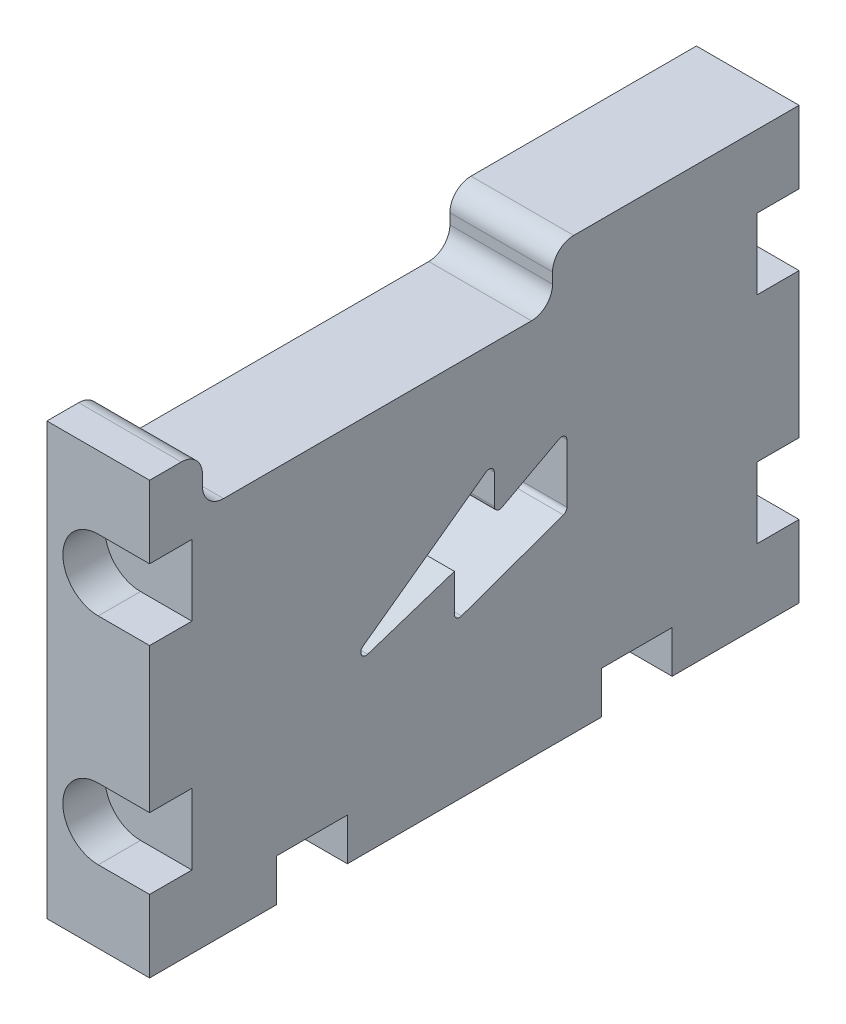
SolidWorks part; units mm, degrees
ref_plane "Front Plane" through (0, 0, 0) normal (0, 0, 1) x (1, 0, 0)
ref_plane "Top Plane" through (0, 0, 0) normal (0, 1, 0) x (1, 0, 0)
ref_plane "Right Plane" through (0, 0, 0) normal (1, 0, 0) x (0, 0, -1)
sketch "Sketch1" plane through (0, 0, 0) normal (0, 0, 1) x (1, 0, 0)
  line L6 (-810.8141, 612.9135) -> (-817.6657, 612.9135)
  line L7 (-810.8141, 612.9135) -> (-779.225, 612.9135)
  line L8 (-493.7649, 564.4955) -> (-493.7649, 1167.7963)
  line L9 (-493.7649, 1167.7963) -> (-817.6657, 1167.7963)
  line L10 (-817.6657, 1167.7963) -> (-817.6657, 564.4955)
  line L11 (-817.6657, 564.4955) -> (-493.7649, 564.4955)
  line L12 (-779.225, 612.9135) -> (-779.225, 571.3471)
  line L13 (-779.225, 571.3471) -> (-779.225, 564.4955)
  circle A2 centre (-798.6157, 583.5455) radius 2.667
extrude "Boss-Extrude1" add sketch "Sketch1" along normal blind 6.35 contours L13 L12 L7 L6 L10 L11 A2
sketch "Sketch2" plane through (0, 0, 6.35) normal (0, 0, 1) x (1, 0, 0)
  line L0 (-779.225, 564.4955) -> (-779.225, 555.0975)
  line L1 (-817.6657, 612.9135) -> (-827.0637, 612.9135)
  line L3 (-827.0637, 612.9135) -> (-779.225, 612.9135)
  line L4 (-779.225, 564.4955) -> (-779.225, 612.9135)
  line L5 (-779.225, 612.9135) -> (-817.6657, 612.9135)
  line L6 (-817.6657, 612.9135) -> (-817.6657, 564.4955)
  line L7 (-817.6657, 564.4955) -> (-779.225, 564.4955)
  line L8 (-779.225, 564.4955) -> (-779.225, 612.9135)
  line L9 (-779.225, 612.9135) -> (-817.6657, 612.9135)
  line L10 (-817.6657, 612.9135) -> (-817.6657, 564.4955)
  line L11 (-817.6657, 564.4955) -> (-779.225, 564.4955)
  line L12 (-827.0637, 612.9135) -> (-827.0637, 555.0975)
  line L13 (-827.0637, 555.0975) -> (-779.225, 555.0975)
  line L14 (-779.225, 612.9135) -> (-779.225, 555.0975)
  dimension "D2" = 9.398
  dimension "D1" = 0
extrude "Boss-Extrude2" add sketch "Sketch2" against normal up to vertex (996.0964 mm away) contours L12 L13 L0 L1 M15 M14
sketch "Sketch6" plane through (0, 0, 0) normal (0, 0, -1) x (-1, 0, 0)
  line L4 (779.225, 612.9135) -> (779.225, 555.0975)
  line L5 (779.225, 555.0975) -> (827.0637, 555.0975)
  line L6 (827.0637, 555.0975) -> (827.0637, 612.9135)
  line L7 (827.0637, 612.9135) -> (779.225, 612.9135)
  line L8 (779.225, 612.9135) -> (779.225, 555.0975)
  line L9 (779.225, 555.0975) -> (827.0637, 555.0975)
  line L10 (827.0637, 555.0975) -> (827.0637, 612.9135)
  line L11 (827.0637, 612.9135) -> (779.225, 612.9135)
  line L12 (804.9657, 562.1587) -> (817.4117, 562.1587)
  line L14 (819.1897, 562.1587) -> (820.0025, 562.1587)
  line L15 (820.0025, 562.1587) -> (820.0025, 612.9135)
  line L20 (817.4117, 562.1587) -> (819.1897, 562.1587)
  line L21 (804.9657, 562.1587) -> (779.225, 562.1587)
  dimension "D1" = 0
extrude "Boss-Extrude4" add sketch "Sketch6" along normal up to surface (78.0796 mm away) contours L12 L21 L8 L15 L14 L20 M11 M12 M13
sketch "Sketch7" plane through (0, 0, -78.0796) normal (0, 0, -1) x (-1, 0, 0)
  line L6 (805.2197, 576.9415) -> (805.2197, 612.9135)
  line L7 (779.225, 576.9415) -> (804.6609, 576.9415)
  line L8 (820.0025, 612.9135) -> (827.0637, 612.9135)
  line L9 (827.0637, 612.9135) -> (827.0637, 555.0975)
  line L10 (827.0637, 555.0975) -> (779.225, 555.0975)
  line L11 (779.225, 555.0975) -> (779.225, 562.1587)
  line L12 (779.225, 562.1587) -> (779.225, 576.9415)
  line L13 (820.0025, 612.9135) -> (805.2197, 612.9135)
  line L14 (804.6609, 576.9415) -> (805.2197, 576.9415)
  circle A2 centre (791.9609, 571.3471) radius 2.3812
  circle A3 centre (810.8141, 600.2587) radius 2.3812
sketch "Sketch8" plane through (0, 0, -78.0796) normal (0, 0, -1) x (-1, 0, 0)
  line L9 (805.2197, 612.9135) -> (805.2197, 576.9415)
  line L10 (820.0025, 612.9135) -> (805.2197, 612.9135)
  line L11 (827.0637, 612.9135) -> (820.0025, 612.9135)
  line L12 (827.0637, 555.0975) -> (827.0637, 612.9135)
  line L13 (779.225, 555.0975) -> (827.0637, 555.0975)
  line L14 (779.225, 562.1587) -> (779.225, 555.0975)
  line L15 (779.225, 576.9415) -> (779.225, 562.1587)
  line L16 (804.6609, 576.9415) -> (779.225, 576.9415)
  line L17 (805.2197, 576.9415) -> (804.6609, 576.9415)
  line L18 (805.2197, 612.9135) -> (805.2197, 576.9415)
  line L19 (820.0025, 612.9135) -> (805.2197, 612.9135)
  line L20 (827.0637, 612.9135) -> (820.0025, 612.9135)
  line L21 (827.0637, 555.0975) -> (827.0637, 612.9135)
  line L22 (779.225, 555.0975) -> (827.0637, 555.0975)
  line L23 (779.225, 562.1587) -> (779.225, 555.0975)
  line L24 (779.225, 576.9415) -> (779.225, 562.1587)
  line L25 (804.6609, 576.9415) -> (779.225, 576.9415)
  line L26 (805.2197, 576.9415) -> (804.6609, 576.9415)
  circle A1 centre (810.8141, 600.2587) radius 2.3813
  circle A2 centre (810.8141, 600.2587) radius 2.3812
  circle A3 centre (791.9609, 571.3471) radius 2.3813
  circle A4 centre (791.9609, 571.3471) radius 2.3812
  dimension "D1" = 0
  dimension "D2" = 0
  dimension "D3" = 0
extrude "Boss-Extrude6" add sketch "Sketch8" along normal blind 2.54
other "Cavity1"
other "5 SIDED ENCLOSURE 3 INCH.stp<1>@Assem11"
sketch "Sketch9" plane through (0, 612.9135, 0) normal (0, 1, 0) x (1, 0, 0)
  line L0 (-820.7645, 76.454) -> (-820.8153, 73.0504)
  line L1 (-820.8153, 3.1496) -> (-820.8153, 0)
  line L2 (-820.8153, 0) -> (-820.0025, 0)
  line L3 (-820.0025, 76.454) -> (-820.0025, 78.0796)
  line L4 (-820.0025, 78.0796) -> (-820.0025, 0)
  line L5 (-820.8153, 0) -> (-821.0693, 0)
  line L6 (-821.0693, 0) -> (-821.0693, 78.0796)
  line L7 (-821.0693, 78.0796) -> (-820.7645, 78.0796)
  line L12 (-820.7645, 76.454) -> (-820.7645, 78.0796)
  line L13 (-820.7645, 78.0796) -> (-805.2197, 78.0796)
  line L14 (-805.2197, 78.0796) -> (-805.2197, 80.6196)
  line L15 (-805.2197, 80.6196) -> (-827.0637, 80.6196)
  line L16 (-827.0637, 80.6196) -> (-827.0637, -6.35)
  line L17 (-827.0637, -6.35) -> (-779.225, -6.35)
  line L18 (-779.225, -6.35) -> (-779.225, 0)
  line L19 (-779.225, 0) -> (-820.0025, 0)
  line L20 (-820.0025, 0) -> (-820.0025, 1.0379)
  line L21 (-820.8153, 3.1496) -> (-820.8153, 73.0504)
  line L22 (-820.0025, 75.1621) -> (-820.0025, 76.454)
  line L23 (-820.0025, 76.454) -> (-820.7645, 76.454)
  line L24 (-820.7645, 76.454) -> (-820.7645, 78.0796)
  line L25 (-820.7645, 78.0796) -> (-805.2197, 78.0796)
  line L26 (-805.2197, 78.0796) -> (-805.2197, 80.6196)
  line L27 (-805.2197, 80.6196) -> (-827.0637, 80.6196)
  line L28 (-827.0637, 80.6196) -> (-827.0637, -6.35)
  line L29 (-827.0637, -6.35) -> (-779.225, -6.35)
  line L30 (-779.225, -6.35) -> (-779.225, 0)
  line L31 (-779.225, 0) -> (-820.0025, 0)
  line L32 (-820.0025, 0) -> (-820.0025, 1.0379)
  line L33 (-820.8153, 3.1496) -> (-820.8153, 73.0504)
  line L34 (-820.0025, 75.1621) -> (-820.0025, 76.454)
  line L35 (-820.0025, 76.454) -> (-820.7645, 76.454)
  arc A2 (-820.8153, 3.1496) -> (-820.0025, 1.0379) centre (-817.6657, 3.1496) ccw
  arc A3 (-820.0025, 75.1621) -> (-820.8153, 73.0504) centre (-817.6657, 73.0504) ccw
  arc A4 (-820.8153, 3.1496) -> (-820.0025, 1.0379) centre (-817.6657, 3.1496) ccw
  arc A5 (-820.0025, 75.1621) -> (-820.8153, 73.0504) centre (-817.6657, 73.0504) ccw
  dimension "D2" = 0.254
  dimension "D1" = 0
extrude "Cut-Extrude3" cut sketch "Sketch9" against normal up to surface (50.7548 mm away) contours L0 M28 M26 M27 | L7 L6 L5 L1 L0 M25 M26 M15 | L1 L2 M23 M24
sketch "Sketch10" plane through (-779.225, 0, 0) normal (1, 0, 0) x (0, 0, -1)
  line L0 (78.0796, 561.3459) -> (78.0796, 561.0919)
  line L1 (78.0796, 561.0919) -> (0, 561.0919)
  line L2 (0, 561.0919) -> (0, 562.1587)
  line L4 (24.4475, 562.1587) -> (24.4475, 561.3459) construction
  line L5 (24.4475, 562.1587) -> (24.4475, 561.3459)
  line L6 (0, 562.4127) -> (0, 562.1587)
  line L7 (0, 562.4127) -> (78.0796, 562.4127)
  line L8 (76.1963, 562.4127) -> (76.1963, 562.1587)
  line L9 (78.0796, 562.4127) -> (76.1963, 562.4127)
  line L10 (78.0796, 562.4127) -> (78.0796, 565.7277)
  line L11 (78.0796, 565.7277) -> (76.1963, 565.7277)
  line L12 (78.0796, 576.9415) -> (78.0796, 561.3459)
  line L13 (78.0796, 561.3459) -> (76.454, 561.3459)
  line L14 (76.454, 561.3459) -> (76.454, 562.1587)
  line L15 (76.454, 562.1587) -> (75.1621, 562.1587)
  line L16 (73.0504, 561.3459) -> (3.1496, 561.3459)
  line L17 (1.0379, 562.1587) -> (0, 562.1587)
  line L18 (0, 562.1587) -> (0, 612.9135)
  line L19 (0, 612.9135) -> (-6.35, 612.9135)
  line L20 (-6.35, 612.9135) -> (-6.35, 555.0975)
  line L21 (-6.35, 555.0975) -> (80.6196, 555.0975)
  line L22 (80.6196, 555.0975) -> (80.6196, 576.9415)
  line L23 (80.6196, 576.9415) -> (78.0796, 576.9415)
  line L24 (78.0796, 576.9415) -> (78.0796, 561.3459)
  line L25 (78.0796, 561.3459) -> (76.454, 561.3459)
  line L26 (76.454, 561.3459) -> (76.454, 562.1587)
  line L27 (76.454, 562.1587) -> (75.1621, 562.1587)
  line L28 (73.0504, 561.3459) -> (3.1496, 561.3459)
  line L29 (1.0379, 562.1587) -> (0, 562.1587)
  line L30 (0, 562.1587) -> (0, 612.9135)
  line L31 (0, 612.9135) -> (-6.35, 612.9135)
  line L32 (-6.35, 612.9135) -> (-6.35, 555.0975)
  line L33 (-6.35, 555.0975) -> (80.6196, 555.0975)
  line L34 (80.6196, 555.0975) -> (80.6196, 576.9415)
  line L35 (80.6196, 576.9415) -> (78.0796, 576.9415)
  line L36 (76.1963, 562.4127) -> (76.1963, 565.7277)
  line L37 (0, 561.0919) -> (3.4229, 561.0919)
  line L38 (0, 561.0919) -> (0, 564.0863)
  line L39 (0, 564.0863) -> (3.4229, 564.0863)
  line L40 (3.4229, 561.0919) -> (3.4229, 564.0863)
  arc A2 (73.0504, 561.3459) -> (75.1621, 562.1587) centre (73.0504, 564.4955) ccw
  arc A3 (1.0379, 562.1587) -> (3.1496, 561.3459) centre (3.1496, 564.4955) ccw
  arc A4 (73.0504, 561.3459) -> (75.1621, 562.1587) centre (73.0504, 564.4955) ccw
  arc A5 (1.0379, 562.1587) -> (3.1496, 561.3459) centre (3.1496, 564.4955) ccw
  dimension "D2" = 0.254
  dimension "D3" = 0.254
  dimension "D1" = 0
extrude "Cut-Extrude5" cut sketch "Sketch10" against normal up to surface (41.8444 mm away)
sketch "Sketch12" plane through (0, 0, -80.6196) normal (0, 0, -1) x (-1, 0, 0)
  line L6 (827.0637, 612.9135) -> (805.2197, 612.9135)
  line L7 (805.2197, 612.9135) -> (805.2197, 576.9415)
  line L8 (805.2197, 576.9415) -> (779.225, 576.9415)
  line L9 (779.225, 576.9415) -> (779.225, 555.0975)
  line L10 (779.225, 555.0975) -> (827.0637, 555.0975)
  line L11 (827.0637, 555.0975) -> (827.0637, 612.9135)
  line L12 (827.0637, 612.9135) -> (805.2197, 612.9135)
  line L13 (805.2197, 612.9135) -> (805.2197, 576.9415)
  line L14 (805.2197, 576.9415) -> (779.225, 576.9415)
  line L15 (779.225, 576.9415) -> (779.225, 555.0975)
  line L16 (779.225, 555.0975) -> (827.0637, 555.0975)
  line L17 (827.0637, 555.0975) -> (827.0637, 612.9135)
  circle A1 centre (791.9609, 571.3471) radius 2.3813
  circle A2 centre (791.9609, 571.3471) radius 2.3812
  circle A3 centre (810.8141, 600.2587) radius 2.3813
  circle A4 centre (810.8141, 600.2587) radius 2.3812
  dimension "D1" = 0
  dimension "D2" = 0
  dimension "D3" = 0
extrude "Boss-Extrude7" add sketch "Sketch12" along normal blind 3.81
sketch "Sketch13" plane through (0, 0, -84.4296) normal (0, 0, -1) x (-1, 0, 0)
  line L0 (797.5235, 571.3471) -> (797.5235, 576.9415)
  line L1 (805.2197, 576.9415) -> (779.225, 576.9415) construction
  line L2 (786.3983, 571.3471) -> (786.3983, 576.9415)
  line L3 (810.8141, 594.6961) -> (805.2197, 594.6961)
  line L4 (805.2197, 612.9135) -> (805.2197, 576.9415) construction
  line L5 (810.8141, 605.8213) -> (805.2197, 605.8213)
  line L12 (827.0637, 612.9135) -> (805.2197, 612.9135)
  line L13 (805.2197, 612.9135) -> (805.2197, 576.9415)
  line L14 (805.2197, 576.9415) -> (779.225, 576.9415)
  line L15 (779.225, 576.9415) -> (779.225, 555.0975)
  line L16 (779.225, 555.0975) -> (827.0637, 555.0975)
  line L17 (827.0637, 555.0975) -> (827.0637, 612.9135)
  line L18 (827.0637, 612.9135) -> (805.2197, 612.9135)
  line L19 (805.2197, 612.9135) -> (805.2197, 576.9415)
  line L20 (805.2197, 576.9415) -> (779.225, 576.9415)
  line L21 (779.225, 576.9415) -> (779.225, 555.0975)
  line L22 (779.225, 555.0975) -> (827.0637, 555.0975)
  line L23 (827.0637, 555.0975) -> (827.0637, 612.9135)
  circle A2 centre (810.8141, 600.2587) radius 3.0226
  circle A3 centre (791.9609, 571.3471) radius 3.0226
  circle A4 centre (791.9609, 571.3471) radius 5.5626
  circle A5 centre (810.8141, 600.2587) radius 5.5626
  dimension "D1" = 2.54
  dimension "D2" = 0
extrude "Cut-Extrude7" cut sketch "Sketch13" against normal blind 5.715 contours M16 | A5 A2 | A5 L5 L3 M7 | M3 | A3 M3 | A4 A3 | A4 L0 L2 M9
fillet "Fillet3" radius 1.27 4 edges at (-805.2197, 605.8213, -81.5721) (-805.2197, 594.6961, -81.5721) (-797.5235, 576.9415, -81.5721) (-786.3983, 576.9415, -81.5721)
sketch "Sketch14" plane through (0, 0, 6.35) normal (0, 0, 1) x (1, 0, 0)
  line L4 (-779.225, 612.9135) -> (-827.0637, 612.9135)
  line L5 (-827.0637, 612.9135) -> (-827.0637, 555.0975)
  line L6 (-827.0637, 555.0975) -> (-779.225, 555.0975)
  line L7 (-779.225, 555.0975) -> (-779.225, 612.9135)
  line L8 (-779.225, 612.9135) -> (-827.0637, 612.9135)
  line L9 (-827.0637, 612.9135) -> (-827.0637, 555.0975)
  line L10 (-827.0637, 555.0975) -> (-779.225, 555.0975)
  line L11 (-779.225, 555.0975) -> (-779.225, 612.9135)
  circle A1 centre (-798.6157, 583.5455) radius 12.7
  circle A2 centre (-798.6157, 583.5455) radius 12.954
  dimension "D1" = 0
  dimension "D2" = 0.254
extrude "Cut-Extrude8" cut sketch "Sketch14" against normal blind 5.715 contours A2 A1 | A1 M9 | M9
fillet "Fillet4" radius 2.54 3 edges at (-779.225, 576.9415, -81.2546) (-805.2197, 612.9135, -81.2546) (-779.225, 612.9135, 3.175)
sketch "Sketch15" plane through (-779.225, 0, 0) normal (1, 0, 0) x (0, 0, -1)
  line L4 (-6.35, 612.9135) -> (-6.35, 555.0975)
  line L5 (84.4296, 612.9135) -> (-6.35, 612.9135)
  line L6 (84.4296, 555.0975) -> (84.4296, 612.9135)
  line L7 (-6.35, 555.0975) -> (84.4296, 555.0975)
  line L8 (-6.35, 612.9135) -> (-6.35, 555.0975)
  line L9 (84.4296, 612.9135) -> (-6.35, 612.9135)
  line L10 (84.4296, 555.0975) -> (84.4296, 612.9135)
  line L11 (-6.35, 555.0975) -> (84.4296, 555.0975)
  dimension "D1" = 0
extrude "Cut-Extrude9" cut sketch "Sketch15" against normal up to surface (41.8444 mm away)
sketch "Sketch16" plane through (-827.0637, 0, 0) normal (-1, 0, 0) x (0, 0, 1)
  line L4 (6.35, 555.0975) -> (6.35, 612.9135)
  line L5 (6.35, 612.9135) -> (-84.4296, 612.9135)
  line L6 (-84.4296, 612.9135) -> (-84.4296, 555.0975)
  line L7 (-84.4296, 555.0975) -> (6.35, 555.0975)
  line L8 (6.35, 555.0975) -> (6.35, 612.9135)
  line L9 (6.35, 612.9135) -> (-84.4296, 612.9135)
  line L10 (-84.4296, 612.9135) -> (-84.4296, 555.0975)
  line L11 (-84.4296, 555.0975) -> (6.35, 555.0975)
  dimension "D1" = 0
extrude "Boss-Extrude8" add sketch "Sketch16" along normal blind 6.35
sketch "Sketch17" plane through (0, 555.0975, 0) normal (0, -1, 0) x (1, 0, 0)
  line L4 (-833.4137, -84.4296) -> (-821.0693, -84.4296)
  line L5 (-821.0693, -84.4296) -> (-821.0693, 6.35)
  line L6 (-821.0693, 6.35) -> (-833.4137, 6.35)
  line L7 (-833.4137, 6.35) -> (-833.4137, -84.4296)
  line L8 (-833.4137, -84.4296) -> (-821.0693, -84.4296)
  line L9 (-821.0693, -84.4296) -> (-821.0693, 6.35)
  line L10 (-821.0693, 6.35) -> (-833.4137, 6.35)
  line L11 (-833.4137, 6.35) -> (-833.4137, -84.4296)
  dimension "D1" = 0
extrude "Boss-Extrude9" add sketch "Sketch17" along normal up to surface (6.35 mm away)
other "Cavity2"
other "Bottom<1>@Bumper Assembly1"
other "Top<1>@Bumper Assembly1"
other "Cavity3"
other "Short Side<1>@Bumper Assembly1"
sketch "Sketch18" plane through (0, 561.0919, 0) normal (0, -1, 0) x (1, 0, 0)
  line L0 (-827.0637, 0) -> (-827.0637, -78.0796)
  line L8 (-821.0693, -78.0796) -> (-821.0693, 0)
  line L9 (-821.0693, 0) -> (-827.0637, 0)
  line L10 (-827.0637, 0) -> (-827.0637, 6.35)
  line L11 (-827.0637, 6.35) -> (-833.4137, 6.35)
  line L12 (-833.4137, 6.35) -> (-833.4137, -84.4296)
  line L13 (-833.4137, -84.4296) -> (-827.0637, -84.4296)
  line L14 (-827.0637, -84.4296) -> (-827.0637, -78.0796)
  line L15 (-827.0637, -78.0796) -> (-821.0693, -78.0796)
  line L16 (-821.0693, -78.0796) -> (-821.0693, 0)
  line L17 (-821.0693, 0) -> (-827.0637, 0)
  line L18 (-827.0637, 0) -> (-827.0637, 6.35)
  line L19 (-827.0637, 6.35) -> (-833.4137, 6.35)
  line L20 (-833.4137, 6.35) -> (-833.4137, -84.4296)
  line L21 (-833.4137, -84.4296) -> (-827.0637, -84.4296)
  line L22 (-827.0637, -84.4296) -> (-827.0637, -78.0796)
  line L23 (-827.0637, -78.0796) -> (-821.0693, -78.0796)
  dimension "D1" = 0
extrude "Boss-Extrude10" add sketch "Sketch18" along normal blind 6.223 contours L0 M12 M13 M14 M15 M16
sketch "Sketch19" plane through (-833.4137, 0, 0) normal (-1, 0, 0) x (0, 0, 1)
  line L0 (-52.9158, 586.6596) -> (-52.9158, 578.1369)
  line L1 (-52.9158, 578.1369) -> (-39.386, 573.2896)
  line L2 (-39.386, 573.2896) -> (-39.386, 578.6696)
  line L3 (-39.386, 578.6696) -> (-25.1105, 573.9821)
  line L4 (-25.1105, 573.9821) -> (-44.1801, 587.8315)
  line L5 (-44.1801, 587.8315) -> (-44.1801, 581.9721)
  line L6 (-44.1801, 581.9721) -> (-52.9158, 586.6596)
extrude "Cut-Extrude10" [suppressed] cut sketch "Sketch19" against normal through all
other "Cavity4"
other "Bumper Assembly<1>@Assem1/Short Side<1>@Bumper Assembly1"
sketch "Sketch20" plane through (-833.4137, 0, 0) normal (-1, 0, 0) x (0, 0, 1)
  line L0 (6.35, 606.5635) -> (-84.4296, 606.5635)
  line L1 (-6.35, 555.0975) -> (-6.35, 612.9135)
  line L2 (-71.7296, 612.9135) -> (-71.7296, 555.0975)
  line L4 (-84.4296, 555.0975) -> (6.35, 555.0975)
  line L5 (6.35, 555.0975) -> (6.35, 612.9135)
  line L6 (6.35, 612.9135) -> (-84.4296, 612.9135)
  line L7 (-84.4296, 612.9135) -> (-84.4296, 555.0975)
  line L9 (6.35, 555.0975) -> (6.35, 612.9135)
  line L10 (6.35, 612.9135) -> (-84.4296, 612.9135)
  line L11 (-84.4296, 612.9135) -> (-84.4296, 555.0975)
  line L15 (-84.4296, 555.0975) -> (6.35, 555.0975)
  dimension "D1" = 0
  dimension "D2" = 6.35
  dimension "D3" = 12.7
extrude "Cut-Extrude11" cut sketch "Sketch20" against normal up to surface (12.5984 mm away) contours L2 L0 L1 M8
fillet "Fillet5" radius 2.54 1 edges at (-827.2415, 606.5635, -6.35)
fillet "Fillet6" radius 2.54 1 edges at (-827.2415, 612.9135, -6.35)
sketch "Sketch21" plane through (-833.4137, 0, 0) normal (-1, 0, 0) x (0, 0, 1)
  line L0 (-27.3967, 618.0752) -> (-27.3967, 623.9576)
  line L1 (-48.4434, 610.3735) -> (-48.4434, 609.1035)
  line L2 (-14.1267, 613.4714) -> (-14.1267, 628.0114)
  line L3 (-40.6667, 616.4063) -> (-40.6667, 618.0752)
  line L4 (-40.6667, 618.0752) -> (-14.1267, 618.0752)
  line L5 (-61.1434, 612.9135) -> (-50.9834, 612.9135)
  line L6 (-61.1434, 612.9135) -> (-71.7296, 612.9135)
  line L8 (6.35, 612.9135) -> (-3.81, 612.9135)
  line L9 (-6.35, 610.3735) -> (-6.35, 609.1035)
  line L10 (-8.89, 606.5635) -> (-71.7296, 606.5635)
  line L11 (-71.7296, 606.5635) -> (-71.7296, 612.9135)
  line L12 (-71.7296, 612.9135) -> (-84.4296, 612.9135)
  line L13 (-84.4296, 612.9135) -> (-84.4296, 555.0975)
  line L14 (-84.4296, 555.0975) -> (6.35, 555.0975)
  line L15 (6.35, 555.0975) -> (6.35, 612.9135)
  line L16 (6.35, 612.9135) -> (-3.81, 612.9135)
  line L17 (-6.35, 610.3735) -> (-6.35, 609.1035)
  line L18 (-8.89, 606.5635) -> (-71.7296, 606.5635)
  line L19 (-71.7296, 606.5635) -> (-71.7296, 612.9135)
  line L20 (-71.7296, 612.9135) -> (-84.4296, 612.9135)
  line L21 (-84.4296, 612.9135) -> (-84.4296, 555.0975)
  line L22 (-84.4296, 555.0975) -> (6.35, 555.0975)
  line L23 (6.35, 555.0975) -> (6.35, 612.9135)
  arc A0 (-45.9034, 606.5635) -> (-48.4434, 609.1035) centre (-45.9034, 609.1035) cw
  arc A1 (-50.9834, 612.9135) -> (-48.4434, 610.3735) centre (-50.9834, 610.3735) cw
  arc A2 (-3.81, 612.9135) -> (-6.35, 610.3735) centre (-3.81, 610.3735) ccw
  arc A3 (-8.89, 606.5635) -> (-6.35, 609.1035) centre (-8.89, 609.1035) ccw
  arc A4 (-3.81, 612.9135) -> (-6.35, 610.3735) centre (-3.81, 610.3735) ccw
  arc A5 (-8.89, 606.5635) -> (-6.35, 609.1035) centre (-8.89, 609.1035) ccw
  dimension "D1" = 0
extrude "Boss-Extrude11" add sketch "Sketch21" against normal up to surface (12.3444 mm away) contours A1 L5 L6 L18 A0 L1 M16
other "Cavity5"
other "Bumper Assembly<1>@CORNER MOUNT ASSEMBLY/Bottom<1>@Bumper Assembly1"
other "Bumper Assembly<1>@CORNER MOUNT ASSEMBLY/Top<1>@Bumper Assembly1"
other "Cavity6"
other "Bumper Assembly<1>@CORNER MOUNT ASSEMBLY/Short Side<1>@Bumper Assembly1"
sketch "Sketch22" plane through (0, 561.0919, 0) normal (0, -1, 0) x (1, 0, 0)
  line L6 (-827.2415, -54.3052) -> (-821.0693, -54.3052)
  line L7 (-821.0693, -54.3052) -> (-821.0693, -62.8142)
  line L8 (-821.0693, -62.8142) -> (-827.2415, -62.8142)
  line L9 (-827.2415, -15.2654) -> (-821.0693, -15.2654)
  line L10 (-821.0693, -15.2654) -> (-821.0693, -23.7744)
  line L11 (-821.0693, -23.7744) -> (-827.2415, -23.7744)
  arc A2 (-827.2415, -54.3052) -> (-827.2415, -62.8142) centre (-827.2415, -58.5597) ccw
  arc A3 (-827.2415, -15.2654) -> (-827.2415, -23.7744) centre (-827.2415, -19.5199) ccw
extrude "Cut-Extrude12" cut sketch "Sketch22" against normal blind 5.08
sketch "Sketch24" plane through (0, 0, 0) normal (0, 0, 1) x (1, 0, 0)
  line L1 (-493.7649, 564.4955) -> (-817.6657, 564.4955)
  line L8 (-484.1891, 604.2126) -> (-490.3613, 604.2126)
  line L9 (-490.3613, 604.2126) -> (-490.3613, 595.7036)
  line L10 (-490.3613, 595.7036) -> (-484.1891, 595.7036)
  line L11 (-484.1891, 578.3018) -> (-490.3613, 578.3018)
  line L12 (-490.3613, 578.3018) -> (-490.3613, 569.7928)
  line L13 (-490.3613, 569.7928) -> (-484.1891, 569.7928)
  line L14 (-655.7153, 564.4955) -> (-655.7153, 539.2154)
  line L15 (-821.0693, 569.7928) -> (-827.2415, 569.7928)
  line L16 (-821.0693, 578.3018) -> (-821.0693, 569.7928)
  line L17 (-827.2415, 578.3018) -> (-821.0693, 578.3018)
  line L18 (-821.0693, 595.7036) -> (-827.2415, 595.7036)
  line L19 (-821.0693, 604.2126) -> (-821.0693, 595.7036)
  line L20 (-827.2415, 604.2126) -> (-821.0693, 604.2126)
  arc A2 (-484.1891, 595.7036) -> (-484.1891, 604.2126) centre (-484.1891, 599.9581) ccw
  arc A3 (-484.1891, 569.7928) -> (-484.1891, 578.3018) centre (-484.1891, 574.0473) ccw
  arc A4 (-827.2415, 569.7928) -> (-827.2415, 578.3018) centre (-827.2415, 574.0473) cw
  arc A5 (-827.2415, 595.7036) -> (-827.2415, 604.2126) centre (-827.2415, 599.9581) cw
extrude "Cut-Extrude14" cut sketch "Sketch24" against normal blind 5.08 contours A4 L15 L17 M4 | A5 L18 L20 M4
sketch "Sketch25" plane through (0, 0, -78.0796) normal (0, 0, -1) x (-1, 0, 0)
  line L1 (818.2245, 561.3459) -> (493.1045, 561.3459)
  line L2 (655.6645, 561.3459) -> (655.6645, 523.78)
  line L9 (484.2907, 595.7036) -> (490.3613, 595.7036)
  line L10 (490.3613, 595.7036) -> (490.3613, 604.2126)
  line L11 (490.3613, 604.2126) -> (484.2907, 604.2126)
  line L12 (484.2907, 569.7928) -> (490.3613, 569.7928)
  line L13 (490.3613, 569.7928) -> (490.3613, 578.3018)
  line L14 (490.3613, 578.3018) -> (484.2907, 578.3018)
  line L15 (820.9677, 578.3018) -> (827.0383, 578.3018)
  line L16 (820.9677, 569.7928) -> (820.9677, 578.3018)
  line L17 (827.0383, 569.7928) -> (820.9677, 569.7928)
  line L18 (820.9677, 604.2126) -> (827.0383, 604.2126)
  line L19 (820.9677, 595.7036) -> (820.9677, 604.2126)
  line L20 (827.0383, 595.7036) -> (820.9677, 595.7036)
  arc A2 (484.2907, 604.2126) -> (484.2907, 595.7036) centre (484.2907, 599.9581) ccw
  arc A3 (484.2907, 578.3018) -> (484.2907, 569.7928) centre (484.2907, 574.0473) ccw
  arc A4 (827.0383, 578.3018) -> (827.0383, 569.7928) centre (827.0383, 574.0473) cw
  arc A5 (827.0383, 604.2126) -> (827.0383, 595.7036) centre (827.0383, 599.9581) cw
extrude "Cut-Extrude15" cut sketch "Sketch25" against normal blind 5.08 contours A4 L15 L17 M5 | A5 L18 L20 M5
sketch "Sketch26" plane through (-833.4137, 0, 0) normal (-1, 0, 0) x (0, 0, 1)
  line L14 (-42.372, 588.9161) -> (-49.2373, 592.5999)
  line L15 (-50.1726, 592.0403) -> (-50.1726, 585.026)
  line L16 (-49.7518, 584.4282) -> (-37.492, 580.036)
  line L17 (-36.6428, 580.6337) -> (-36.6428, 585.1117)
  line L18 (-36.6428, 585.1117) -> (-26.2174, 581.6884)
  line L19 (-25.6462, 582.8055) -> (-40.4287, 593.5414)
  line L20 (-41.4368, 593.0276) -> (-41.4368, 589.4756)
  arc A12 (-42.372, 588.9161) -> (-41.4368, 589.4756) centre (-42.0718, 589.4756) ccw
  arc A13 (-49.2373, 592.5999) -> (-50.1726, 592.0403) centre (-49.5376, 592.0403) ccw
  arc A14 (-50.1726, 585.026) -> (-49.7518, 584.4282) centre (-49.5376, 585.026) ccw
  arc A15 (-37.492, 580.036) -> (-36.6428, 580.6337) centre (-37.2778, 580.6337) ccw
  arc A16 (-26.2174, 581.6884) -> (-25.6462, 582.8055) centre (-26.0193, 582.2917) ccw
  arc A17 (-40.4287, 593.5414) -> (-41.4368, 593.0276) centre (-40.8018, 593.0276) ccw
extrude "Cut-Extrude16" cut sketch "Sketch26" against normal through all
